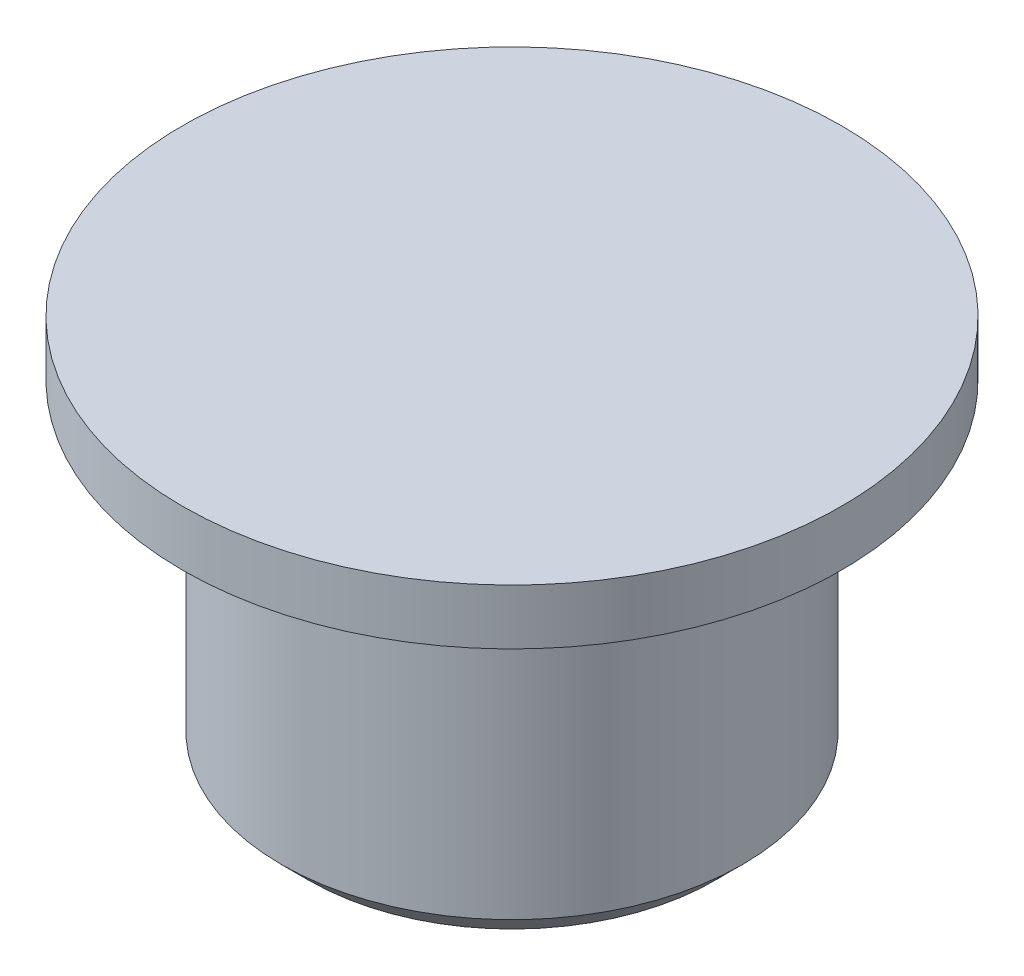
SolidWorks part; units mm, degrees
ref_plane "Plan de face" through (0, 0, 0) normal (0, 0, 1) x (1, 0, 0)
ref_plane "Plan de dessus" through (0, 0, 0) normal (0, 1, 0) x (1, 0, 0)
ref_plane "Plan de droite" through (0, 0, 0) normal (1, 0, 0) x (0, 0, -1)
sketch "Esquisse1" plane through (0, 0, 0) normal (0, 1, 0) x (1, 0, 0)
  circle A0 centre (0, 0) radius 8.33
  dimension "D1" = 16.66
extrude "Extrusion1" add sketch "Esquisse1" along normal blind 12
sketch "Esquisse2" plane through (0, 12, 0) normal (0, 1, 0) x (1, 0, 0)
  circle A0 centre (0, 0) radius 11.9069
extrude "Extrusion2" add sketch "Esquisse2" along normal blind 2
chamfer "Chanfrein1" distance 1 angle 45 1 edges at (0, 0, 8.33)
